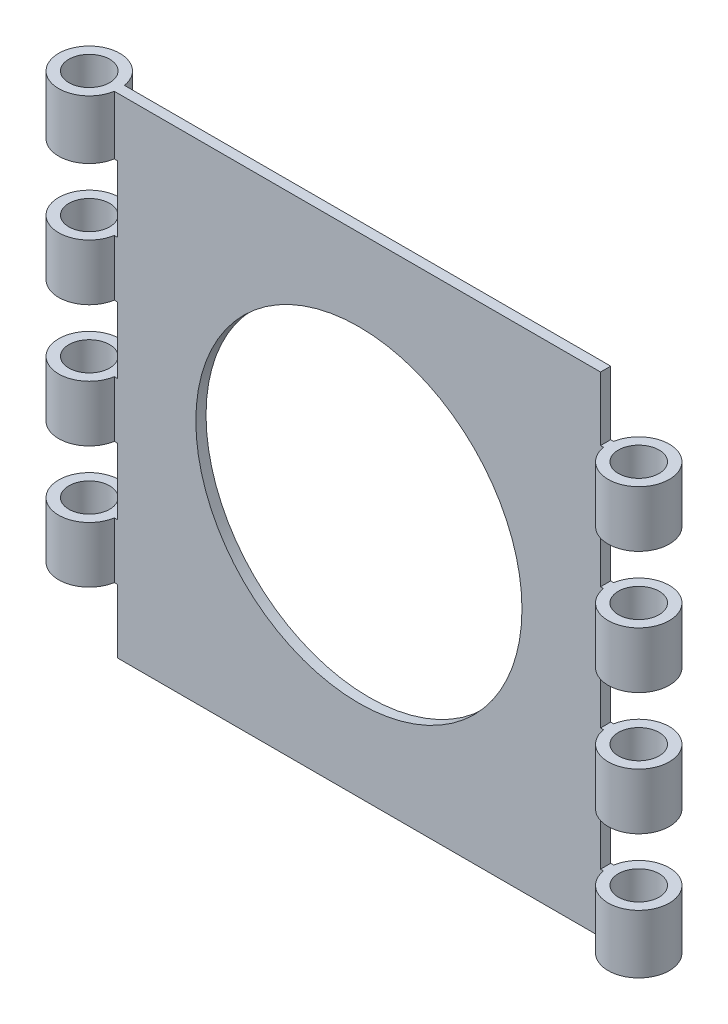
SolidWorks part; units mm, degrees
ref_plane "Front" through (0, 0, 0) normal (0, 0, 1) x (1, 0, 0)
ref_plane "Top" through (0, 0, 0) normal (0, 1, 0) x (1, 0, 0)
ref_plane "Right" through (0, 0, 0) normal (1, 0, 0) x (0, 0, -1)
sketch "Sketch1" plane through (0, 0, 0) normal (0, 0, 1) x (1, 0, 0)
  line L0 (0, 0) -> (76.2, 0)
  line L1 (0, 0) -> (0, 76.2)
  line L2 (76.2, 76.2) -> (0, 76.2)
  line L3 (76.2, 76.2) -> (76.2, 0)
  dimension "D1" = 76.2
  dimension "D2" = 76.2
extrude "Base-Extrude" add sketch "Sketch1" along normal blind 1.5875
sketch "Sketch2" plane through (0, 76.2, 0) normal (0, 1, 0) x (-1, 0, 0)
  line L0 (-76.2, 1.5875) -> (-80.8959, 0.7938) construction
  line L1 (-76.2, 0) -> (-80.8959, 0.7938) construction
  circle A0 centre (-80.8959, 0.7938) radius 4.7625
  dimension "D1" = 9.525
extrude "Boss-Extrude2" add sketch "Sketch2" against normal blind 76.2
sketch "Sketch3"
  circle A0 centre (-82.1292, 12.7605) radius 4.7625
  point P0 (-82.923, 8.0646)
  point P2 (-81.3355, 8.0646)
extrude "Boss-Extrude4" add sketch "Sketch4" against normal blind 76.2
sketch "Sketch4" plane through (82.4329, 0, -0.4879) normal (0, -1, 0) x (1, 0, 0)
  line L0 (-82.4329, 2.0754) -> (-87.1288, 1.2816) construction
  line L1 (-82.4329, 0.4879) -> (-87.1288, 1.2816) construction
  circle A0 centre (-87.1288, 1.2816) radius 4.7625
  dimension "D1" = 9.525
extrude "Boss-Extrude3" add sketch "Sketch3" against normal blind 76.2
sketch "Sketch5" plane through (0, 0, 0) normal (0, 0, -1) x (-1, 0, 0)
  line L0 (-76.2, 76.2) -> (0, 0) construction
  circle A0 centre (-38.1, 38.1) radius 25.4
  dimension "D1" = 50.8
extrude "Cut-Extrude1" cut sketch "Sketch5" against normal through all
ref_plane "Plane1" through (0, 80.8959, 0) normal (0, -1, 0) x (0, 0, 1)
sketch "Sketch6" plane through (0, 0, 1.5875) normal (0, 0, 1) x (1, 0, 0)
  line L0 (72.9566, 25.5374) -> (87.615, 25.5374)
  line L1 (72.9566, 25.5374) -> (72.9566, 50.6626)
  line L2 (87.615, 50.6626) -> (72.9566, 50.6626)
  line L3 (87.615, 50.6626) -> (87.615, 25.5374)
  line L4 (76.2, 38.1) -> (87.615, 38.1) construction
  line L5 (76.2, 76.2) -> (76.2, 0) construction
extrude "Cut-Extrude2" cut sketch "Sketch6" against normal through all and the other way through all
sketch "Sketch7" plane through (0, 0, 0) normal (0, -1, 0) x (1, 0, 0)
  circle A0 centre (80.8959, 0.7938) radius 3.175
  dimension "D1" = 6.35
extrude "Cut-Extrude3" cut sketch "Sketch7" against normal through all
sketch "Sketch8" plane through (0, 0, 0) normal (-1, 0, 0) x (0, 0, 1)
  circle A0 centre (0.7938, 80.8959) radius 3.175
  dimension "D1" = 6.35
extrude "Cut-Extrude4" cut sketch "Sketch8" against normal through all
sketch "Sketch9" plane through (0, 0, 0) normal (0, -1, 0) x (1, 0, 0)
  circle A0 centre (-4.6959, 0.7937) radius 3.175
  dimension "D1" = 6.35
extrude "Cut-Extrude5" cut sketch "Sketch9" against normal through all
sketch "Sketch10" plane through (0, 0, 1.5875) normal (0, 0, 1) x (1, 0, 0)
  line L0 (76.1334, 76.2) -> (85.6584, 76.2) construction
  line L1 (76.1334, 76.2) -> (76.1334, 66.675) construction
  line L2 (85.6584, 66.675) -> (76.1334, 66.675) construction
  line L3 (85.6584, 66.675) -> (85.6584, 76.2) construction
  line L4 (80.8959, 0) -> (80.8959, 76.2) construction
  line L5 (85.6584, 76.2) -> (76.2, 76.2) construction
  line L23 (75.7365, 76.5969) -> (86.0553, 76.5969)
  line L24 (75.7365, 76.5969) -> (75.7365, 66.2781)
  line L25 (86.0553, 66.2781) -> (75.7365, 66.2781)
  line L26 (86.0553, 66.2781) -> (86.0553, 76.5969)
  line L27 (75.7365, 66.2781) -> (86.0553, 76.5969) construction
  line L28 (75.7365, 76.5969) -> (86.0553, 66.2781) construction
  line L29 (80.8959, 71.4375) -> (80.8959, 76.2) construction
  dimension "D1" = 9.525
  dimension "D2" = 0.3969
extrude "Cut-Extrude9" cut sketch "Sketch10" against normal through all and the other way through all
pattern_linear "LPattern1" count 4 spacing 19.05 along (0, -1, 0) of "Cut-Extrude9"
pattern_circular "CirPattern2" count 2 every 180 about axis through (38.1, 38.1, 0) along (0, 0, 1) of "LPattern1", "Cut-Extrude9"
